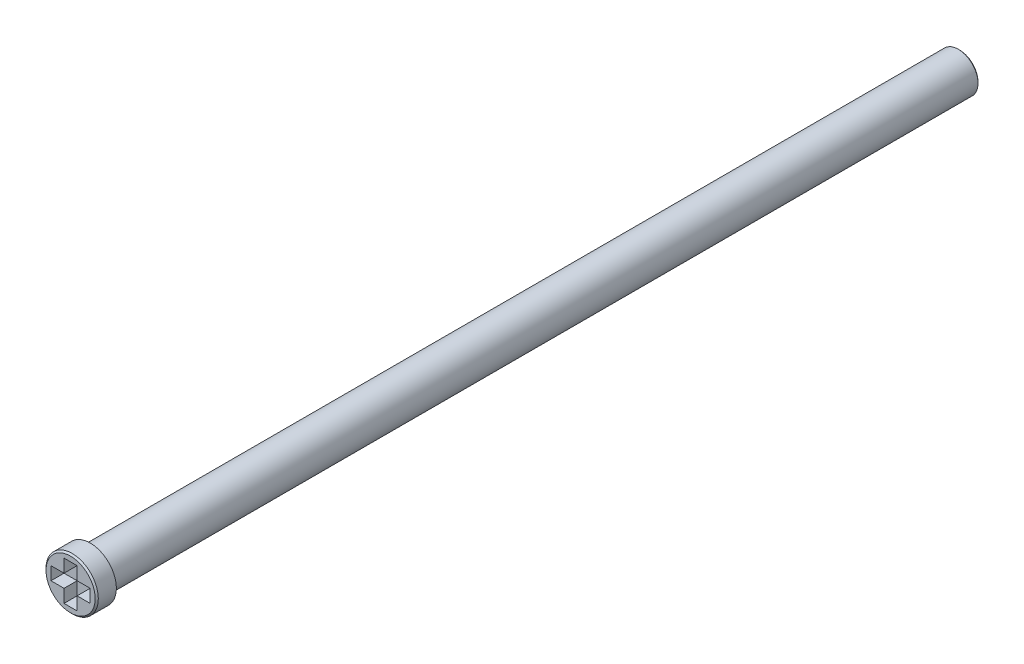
SolidWorks part; units mm, degrees
ref_plane "前视基准面" through (0, 0, 0) normal (0, 0, 1) x (1, 0, 0)
ref_plane "上视基准面" through (0, 0, 0) normal (0, 1, 0) x (1, 0, 0)
ref_plane "右视基准面" through (0, 0, 0) normal (1, 0, 0) x (0, 0, -1)
sketch "草图1" plane through (0, 0, 0) normal (0, 0, 1) x (1, 0, 0)
  circle A0 centre (0, 0) radius 2
  dimension "D1" = 4
extrude "凸台-拉伸1" add sketch "草图1" along normal blind 68
sketch "草图2" plane through (0, 0, 0) normal (0, 0, -1) x (-1, 0, 0)
  circle A0 centre (0, 0) radius 1.5
  dimension "D1" = 3
extrude "切除-拉伸1" cut sketch "草图2" against normal blind 66.5 flip side to cut
chamfer "倒角1" distance 0.1 angle 45 1 edges at (-1.5, 0, 0)
chamfer "倒角2" distance 0.12 angle 45 1 edges at (2, 0, 68)
sketch "草图3" plane through (0, 0, 68) normal (0, 0, 1) x (1, 0, 0)
  line L0 (-0.5, 0.5) -> (-1.5, 0.5)
  line L1 (1.5, 0.5) -> (0.5, 0.5)
  line L2 (1.5, 0.5) -> (1.5, -0.5)
  line L3 (1.5, -0.5) -> (0.5, -0.5)
  line L4 (-1.5, 0.5) -> (-1.5, -0.5)
  line L5 (1.5, 0.5) -> (-1.5, -0.5) construction
  line L6 (1.5, -0.5) -> (-1.5, 0.5) construction
  line L7 (0.5, -1.5) -> (-0.5, -1.5)
  line L8 (0.5, -1.5) -> (0.5, -0.5)
  line L9 (0.5, 1.5) -> (-0.5, 1.5)
  line L10 (-0.5, -1.5) -> (-0.5, -0.5)
  line L11 (0.5, -1.5) -> (-0.5, 1.5) construction
  line L12 (0.5, 1.5) -> (-0.5, -1.5) construction
  line L13 (-0.5, 0.5) -> (-0.5, 1.5)
  line L14 (-0.5, -0.5) -> (-1.5, -0.5)
  line L15 (0.5, 0.5) -> (0.5, 1.5)
  point P0 (0, 0)
  point P6 (0, 0)
  dimension "D1" = 3
  dimension "D2" = 1
  dimension "D3" = 1
  dimension "D4" = 3
extrude "切除-拉伸2" cut sketch "草图3" against normal blind 1
